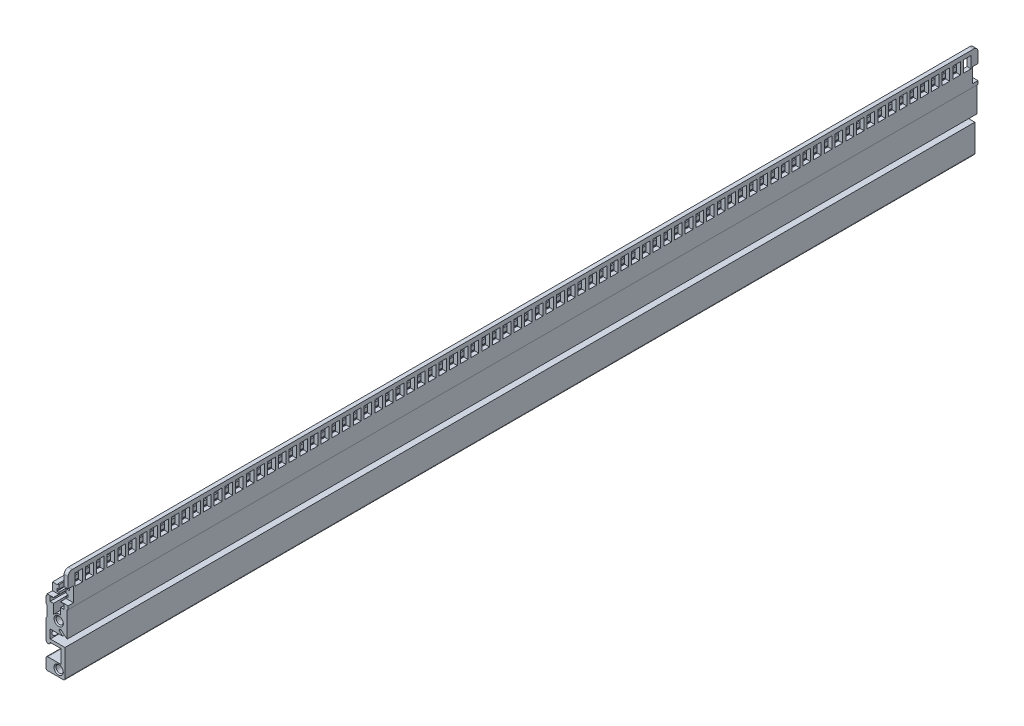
SolidWorks part; units mm, degrees
ref_plane "前视基准面" through (0, 0, 0) normal (0, 0, 1) x (1, 0, 0)
ref_plane "上视基准面" through (0, 0, 0) normal (0, 1, 0) x (1, 0, 0)
ref_plane "右视基准面" through (0, 0, 0) normal (1, 0, 0) x (0, 0, -1)
sketch "草图1" plane through (0, 0, 0) normal (0, 0, 1) x (1, 0, 0)
  line L0 (2.6, 12.5) -> (2.6, 22.5)
  line L1 (0.95, 12.5) -> (2.6, 12.5)
  line L2 (2.6, 22.5) -> (4.5, 22.5)
  line L3 (0.95, 10.55) -> (0.95, 12.5)
  line L4 (4.5, 22.5) -> (4.5, 6.95)
  line L5 (1.85, 10.55) -> (0.95, 10.55)
  line L6 (4, 6.45) -> (4.5, 6.95)
  line L7 (1.85, 9.35) -> (1.85, 10.55)
  line L8 (4, 6.45) -> (4, -5.4458)
  line L9 (0.95, 9.35) -> (1.85, 9.35)
  line L10 (1.2224, -3.1152) -> (4, -5.4458)
  line L11 (0.95, 8.35) -> (0.95, 9.35)
  line L12 (2.55, 8.35) -> (0.95, 8.35)
  line L13 (0.4511, -4.0344) -> (1.8998, -5.25)
  line L14 (2.55, 6.05) -> (2.55, 8.35)
  line L15 (-4, -5.25) -> (1.8998, -5.25)
  line L16 (0.95, 6.05) -> (2.55, 6.05)
  line L17 (-4, -9.35) -> (-4, -5.25)
  line L18 (0.95, 2.9172) -> (0.95, 6.05)
  line L19 (-4, -9.35) -> (3, -9.35)
  line L20 (3, -9.35) -> (3, -22.2)
  line L21 (-2.45, 6.05) -> (-2.45, 1.3077)
  line L22 (-4.05, 6.05) -> (-2.45, 6.05)
  line L23 (2.2, -23) -> (-5.2, -23)
  line L24 (-4.05, 8.35) -> (-4.05, 6.05)
  line L25 (-2.45, 8.35) -> (-4.05, 8.35)
  line L26 (-6, -22.2) -> (-6, -18.05)
  line L27 (-2.45, 9.35) -> (-2.45, 8.35)
  line L28 (-3.35, 9.35) -> (-2.45, 9.35)
  line L29 (-5.2, -17.25) -> (1, -17.25)
  line L30 (-3.35, 10.55) -> (-3.35, 9.35)
  line L31 (1, -10.75) -> (1, -17.25)
  line L32 (-2.45, 10.55) -> (-3.35, 10.55)
  line L33 (-4, -10.75) -> (1, -10.75)
  line L34 (-2.45, 12.5) -> (-2.45, 10.55)
  line L35 (-2.45, 12.5) -> (-3, 12.5)
  line L36 (-6, -10.75) -> (-6, -1.6)
  line L37 (-3, 12.5) -> (-3, 12.1)
  line L38 (-6, -1.6) -> (-5.5501, -1.1002)
  line L39 (-3, 12.1) -> (-5.45, 12.1)
  line L40 (-5.5499, 3.8998) -> (-5.5501, -1.1002)
  line L41 (-5.45, 12.1) -> (-5.45, 7.7)
  line L42 (-5.5499, 3.8998) -> (-6, 4.4)
  line L43 (-5.45, 7.7) -> (-5.7, 7.7)
  line L44 (-6, 4.4) -> (-6, 7.4)
  line L45 (-6, 7.4) -> (-5.7, 7.7)
  circle A0 centre (0, 0) radius 1.7
  circle A1 centre (0, -20) radius 1.7
  arc A2 (1.2224, -3.1152) -> (0.4511, -4.0344) centre (0.8368, -3.5748) ccw
  arc A3 (0.95, 2.9172) -> (-2.45, 1.3077) centre (0.25, 0) ccw
  arc A4 (2.2, -23) -> (3, -22.2) centre (2.2, -22.2) ccw
  arc A5 (-6, -22.2) -> (-5.2, -23) centre (-5.2, -22.2) ccw
  arc A6 (-5.2, -17.25) -> (-6, -18.05) centre (-5.2, -18.05) ccw
  arc A7 (-6, -10.75) -> (-4, -10.75) centre (-5, -10.75) ccw
extrude "凸台-拉伸1" add sketch "草图1" against normal blind 431.8
fillet "圆角1" radius 2 2 edges at (3.55, 22.5, -431.8) (3.55, 22.5, 0)
sketch "草图2" plane through (4.5, 0, 0) normal (1, 0, 0) x (0, 0, -1)
  line L0 (8.36, 20.45) -> (11.96, 20.45)
  line L1 (3.28, 20.45) -> (6.88, 20.45)
  line L2 (3.28, 20.45) -> (3.28, 14.95)
  line L3 (3.28, 14.95) -> (6.88, 14.95)
  line L4 (6.88, 20.45) -> (6.88, 14.95)
  line L5 (5.08, 20.45) -> (5.08, 14.95) construction
  line L6 (3.28, 17.7) -> (6.88, 17.7) construction
  line L7 (429.8, 22.5) -> (2, 22.5) construction
  line L8 (0, 20.5) -> (0, 12.5) construction
  line L9 (8.36, 20.45) -> (8.36, 14.95)
  line L10 (8.36, 14.95) -> (11.96, 14.95)
  line L11 (11.96, 20.45) -> (11.96, 14.95)
  line L12 (10.16, 20.45) -> (10.16, 14.95) construction
  line L13 (8.36, 17.7) -> (11.96, 17.7) construction
  line L14 (13.44, 20.45) -> (17.04, 20.45)
  line L15 (13.44, 20.45) -> (13.44, 14.95)
  line L16 (13.44, 14.95) -> (17.04, 14.95)
  line L17 (17.04, 20.45) -> (17.04, 14.95)
  line L18 (15.24, 20.45) -> (15.24, 14.95) construction
  line L19 (13.44, 17.7) -> (17.04, 17.7) construction
  line L20 (18.52, 20.45) -> (22.12, 20.45)
  line L21 (18.52, 20.45) -> (18.52, 14.95)
  line L22 (18.52, 14.95) -> (22.12, 14.95)
  line L23 (22.12, 20.45) -> (22.12, 14.95)
  line L24 (20.32, 20.45) -> (20.32, 14.95) construction
  line L25 (18.52, 17.7) -> (22.12, 17.7) construction
  line L26 (23.6, 20.45) -> (27.2, 20.45)
  line L27 (23.6, 20.45) -> (23.6, 14.95)
  line L28 (23.6, 14.95) -> (27.2, 14.95)
  line L29 (27.2, 20.45) -> (27.2, 14.95)
  line L30 (25.4, 20.45) -> (25.4, 14.95) construction
  line L31 (23.6, 17.7) -> (27.2, 17.7) construction
  line L32 (28.68, 20.45) -> (32.28, 20.45)
  line L33 (28.68, 20.45) -> (28.68, 14.95)
  line L34 (28.68, 14.95) -> (32.28, 14.95)
  line L35 (32.28, 20.45) -> (32.28, 14.95)
  line L36 (30.48, 20.45) -> (30.48, 14.95) construction
  line L37 (28.68, 17.7) -> (32.28, 17.7) construction
  line L38 (33.76, 20.45) -> (37.36, 20.45)
  line L39 (33.76, 20.45) -> (33.76, 14.95)
  line L40 (33.76, 14.95) -> (37.36, 14.95)
  line L41 (37.36, 20.45) -> (37.36, 14.95)
  line L42 (35.56, 20.45) -> (35.56, 14.95) construction
  line L43 (33.76, 17.7) -> (37.36, 17.7) construction
  line L44 (38.84, 20.45) -> (42.44, 20.45)
  line L45 (38.84, 20.45) -> (38.84, 14.95)
  line L46 (38.84, 14.95) -> (42.44, 14.95)
  line L47 (42.44, 20.45) -> (42.44, 14.95)
  line L48 (40.64, 20.45) -> (40.64, 14.95) construction
  line L49 (38.84, 17.7) -> (42.44, 17.7) construction
  line L50 (43.92, 20.45) -> (47.52, 20.45)
  line L51 (43.92, 20.45) -> (43.92, 14.95)
  line L52 (43.92, 14.95) -> (47.52, 14.95)
  line L53 (47.52, 20.45) -> (47.52, 14.95)
  line L54 (45.72, 20.45) -> (45.72, 14.95) construction
  line L55 (43.92, 17.7) -> (47.52, 17.7) construction
  line L56 (49, 20.45) -> (52.6, 20.45)
  line L57 (49, 20.45) -> (49, 14.95)
  line L58 (49, 14.95) -> (52.6, 14.95)
  line L59 (52.6, 20.45) -> (52.6, 14.95)
  line L60 (50.8, 20.45) -> (50.8, 14.95) construction
  line L61 (49, 17.7) -> (52.6, 17.7) construction
  line L62 (54.08, 20.45) -> (57.68, 20.45)
  line L63 (54.08, 20.45) -> (54.08, 14.95)
  line L64 (54.08, 14.95) -> (57.68, 14.95)
  line L65 (57.68, 20.45) -> (57.68, 14.95)
  line L66 (55.88, 20.45) -> (55.88, 14.95) construction
  line L67 (54.08, 17.7) -> (57.68, 17.7) construction
  line L68 (59.16, 20.45) -> (62.76, 20.45)
  line L69 (59.16, 20.45) -> (59.16, 14.95)
  line L70 (59.16, 14.95) -> (62.76, 14.95)
  line L71 (62.76, 20.45) -> (62.76, 14.95)
  line L72 (60.96, 20.45) -> (60.96, 14.95) construction
  line L73 (59.16, 17.7) -> (62.76, 17.7) construction
  line L74 (64.24, 20.45) -> (67.84, 20.45)
  line L75 (64.24, 20.45) -> (64.24, 14.95)
  line L76 (64.24, 14.95) -> (67.84, 14.95)
  line L77 (67.84, 20.45) -> (67.84, 14.95)
  line L78 (66.04, 20.45) -> (66.04, 14.95) construction
  line L79 (64.24, 17.7) -> (67.84, 17.7) construction
  line L80 (69.32, 20.45) -> (72.92, 20.45)
  line L81 (69.32, 20.45) -> (69.32, 14.95)
  line L82 (69.32, 14.95) -> (72.92, 14.95)
  line L83 (72.92, 20.45) -> (72.92, 14.95)
  line L84 (71.12, 20.45) -> (71.12, 14.95) construction
  line L85 (69.32, 17.7) -> (72.92, 17.7) construction
  line L86 (74.4, 20.45) -> (78, 20.45)
  line L87 (74.4, 20.45) -> (74.4, 14.95)
  line L88 (74.4, 14.95) -> (78, 14.95)
  line L89 (78, 20.45) -> (78, 14.95)
  line L90 (76.2, 20.45) -> (76.2, 14.95) construction
  line L91 (74.4, 17.7) -> (78, 17.7) construction
  line L92 (79.48, 20.45) -> (83.08, 20.45)
  line L93 (79.48, 20.45) -> (79.48, 14.95)
  line L94 (79.48, 14.95) -> (83.08, 14.95)
  line L95 (83.08, 20.45) -> (83.08, 14.95)
  line L96 (81.28, 20.45) -> (81.28, 14.95) construction
  line L97 (79.48, 17.7) -> (83.08, 17.7) construction
  line L98 (84.56, 20.45) -> (88.16, 20.45)
  line L99 (84.56, 20.45) -> (84.56, 14.95)
  line L100 (84.56, 14.95) -> (88.16, 14.95)
  line L101 (88.16, 20.45) -> (88.16, 14.95)
  line L102 (86.36, 20.45) -> (86.36, 14.95) construction
  line L103 (84.56, 17.7) -> (88.16, 17.7) construction
  line L104 (89.64, 20.45) -> (93.24, 20.45)
  line L105 (89.64, 20.45) -> (89.64, 14.95)
  line L106 (89.64, 14.95) -> (93.24, 14.95)
  line L107 (93.24, 20.45) -> (93.24, 14.95)
  line L108 (91.44, 20.45) -> (91.44, 14.95) construction
  line L109 (89.64, 17.7) -> (93.24, 17.7) construction
  line L110 (94.72, 20.45) -> (98.32, 20.45)
  line L111 (94.72, 20.45) -> (94.72, 14.95)
  line L112 (94.72, 14.95) -> (98.32, 14.95)
  line L113 (98.32, 20.45) -> (98.32, 14.95)
  line L114 (96.52, 20.45) -> (96.52, 14.95) construction
  line L115 (94.72, 17.7) -> (98.32, 17.7) construction
  line L116 (99.8, 20.45) -> (103.4, 20.45)
  line L117 (99.8, 20.45) -> (99.8, 14.95)
  line L118 (99.8, 14.95) -> (103.4, 14.95)
  line L119 (103.4, 20.45) -> (103.4, 14.95)
  line L120 (101.6, 20.45) -> (101.6, 14.95) construction
  line L121 (99.8, 17.7) -> (103.4, 17.7) construction
  line L122 (104.88, 20.45) -> (108.48, 20.45)
  line L123 (104.88, 20.45) -> (104.88, 14.95)
  line L124 (104.88, 14.95) -> (108.48, 14.95)
  line L125 (108.48, 20.45) -> (108.48, 14.95)
  line L126 (106.68, 20.45) -> (106.68, 14.95) construction
  line L127 (104.88, 17.7) -> (108.48, 17.7) construction
  line L128 (109.96, 20.45) -> (113.56, 20.45)
  line L129 (109.96, 20.45) -> (109.96, 14.95)
  line L130 (109.96, 14.95) -> (113.56, 14.95)
  line L131 (113.56, 20.45) -> (113.56, 14.95)
  line L132 (111.76, 20.45) -> (111.76, 14.95) construction
  line L133 (109.96, 17.7) -> (113.56, 17.7) construction
  line L134 (115.04, 20.45) -> (118.64, 20.45)
  line L135 (115.04, 20.45) -> (115.04, 14.95)
  line L136 (115.04, 14.95) -> (118.64, 14.95)
  line L137 (118.64, 20.45) -> (118.64, 14.95)
  line L138 (116.84, 20.45) -> (116.84, 14.95) construction
  line L139 (115.04, 17.7) -> (118.64, 17.7) construction
  line L140 (120.12, 20.45) -> (123.72, 20.45)
  line L141 (120.12, 20.45) -> (120.12, 14.95)
  line L142 (120.12, 14.95) -> (123.72, 14.95)
  line L143 (123.72, 20.45) -> (123.72, 14.95)
  line L144 (121.92, 20.45) -> (121.92, 14.95) construction
  line L145 (120.12, 17.7) -> (123.72, 17.7) construction
  line L146 (125.2, 20.45) -> (128.8, 20.45)
  line L147 (125.2, 20.45) -> (125.2, 14.95)
  line L148 (125.2, 14.95) -> (128.8, 14.95)
  line L149 (128.8, 20.45) -> (128.8, 14.95)
  line L150 (127, 20.45) -> (127, 14.95) construction
  line L151 (125.2, 17.7) -> (128.8, 17.7) construction
  line L152 (130.28, 20.45) -> (133.88, 20.45)
  line L153 (130.28, 20.45) -> (130.28, 14.95)
  line L154 (130.28, 14.95) -> (133.88, 14.95)
  line L155 (133.88, 20.45) -> (133.88, 14.95)
  line L156 (132.08, 20.45) -> (132.08, 14.95) construction
  line L157 (130.28, 17.7) -> (133.88, 17.7) construction
  line L158 (135.36, 20.45) -> (138.96, 20.45)
  line L159 (135.36, 20.45) -> (135.36, 14.95)
  line L160 (135.36, 14.95) -> (138.96, 14.95)
  line L161 (138.96, 20.45) -> (138.96, 14.95)
  line L162 (137.16, 20.45) -> (137.16, 14.95) construction
  line L163 (135.36, 17.7) -> (138.96, 17.7) construction
  line L164 (140.44, 20.45) -> (144.04, 20.45)
  line L165 (140.44, 20.45) -> (140.44, 14.95)
  line L166 (140.44, 14.95) -> (144.04, 14.95)
  line L167 (144.04, 20.45) -> (144.04, 14.95)
  line L168 (142.24, 20.45) -> (142.24, 14.95) construction
  line L169 (140.44, 17.7) -> (144.04, 17.7) construction
  line L170 (145.52, 20.45) -> (149.12, 20.45)
  line L171 (145.52, 20.45) -> (145.52, 14.95)
  line L172 (145.52, 14.95) -> (149.12, 14.95)
  line L173 (149.12, 20.45) -> (149.12, 14.95)
  line L174 (147.32, 20.45) -> (147.32, 14.95) construction
  line L175 (145.52, 17.7) -> (149.12, 17.7) construction
  line L176 (150.6, 20.45) -> (154.2, 20.45)
  line L177 (150.6, 20.45) -> (150.6, 14.95)
  line L178 (150.6, 14.95) -> (154.2, 14.95)
  line L179 (154.2, 20.45) -> (154.2, 14.95)
  line L180 (152.4, 20.45) -> (152.4, 14.95) construction
  line L181 (150.6, 17.7) -> (154.2, 17.7) construction
  line L182 (155.68, 20.45) -> (159.28, 20.45)
  line L183 (155.68, 20.45) -> (155.68, 14.95)
  line L184 (155.68, 14.95) -> (159.28, 14.95)
  line L185 (159.28, 20.45) -> (159.28, 14.95)
  line L186 (157.48, 20.45) -> (157.48, 14.95) construction
  line L187 (155.68, 17.7) -> (159.28, 17.7) construction
  line L188 (160.76, 20.45) -> (164.36, 20.45)
  line L189 (160.76, 20.45) -> (160.76, 14.95)
  line L190 (160.76, 14.95) -> (164.36, 14.95)
  line L191 (164.36, 20.45) -> (164.36, 14.95)
  line L192 (162.56, 20.45) -> (162.56, 14.95) construction
  line L193 (160.76, 17.7) -> (164.36, 17.7) construction
  line L194 (165.84, 20.45) -> (169.44, 20.45)
  line L195 (165.84, 20.45) -> (165.84, 14.95)
  line L196 (165.84, 14.95) -> (169.44, 14.95)
  line L197 (169.44, 20.45) -> (169.44, 14.95)
  line L198 (167.64, 20.45) -> (167.64, 14.95) construction
  line L199 (165.84, 17.7) -> (169.44, 17.7) construction
  line L200 (170.92, 20.45) -> (174.52, 20.45)
  line L201 (170.92, 20.45) -> (170.92, 14.95)
  line L202 (170.92, 14.95) -> (174.52, 14.95)
  line L203 (174.52, 20.45) -> (174.52, 14.95)
  line L204 (172.72, 20.45) -> (172.72, 14.95) construction
  line L205 (170.92, 17.7) -> (174.52, 17.7) construction
  line L206 (176, 20.45) -> (179.6, 20.45)
  line L207 (176, 20.45) -> (176, 14.95)
  line L208 (176, 14.95) -> (179.6, 14.95)
  line L209 (179.6, 20.45) -> (179.6, 14.95)
  line L210 (177.8, 20.45) -> (177.8, 14.95) construction
  line L211 (176, 17.7) -> (179.6, 17.7) construction
  line L212 (181.08, 20.45) -> (184.68, 20.45)
  line L213 (181.08, 20.45) -> (181.08, 14.95)
  line L214 (181.08, 14.95) -> (184.68, 14.95)
  line L215 (184.68, 20.45) -> (184.68, 14.95)
  line L216 (182.88, 20.45) -> (182.88, 14.95) construction
  line L217 (181.08, 17.7) -> (184.68, 17.7) construction
  line L218 (186.16, 20.45) -> (189.76, 20.45)
  line L219 (186.16, 20.45) -> (186.16, 14.95)
  line L220 (186.16, 14.95) -> (189.76, 14.95)
  line L221 (189.76, 20.45) -> (189.76, 14.95)
  line L222 (187.96, 20.45) -> (187.96, 14.95) construction
  line L223 (186.16, 17.7) -> (189.76, 17.7) construction
  line L224 (191.24, 20.45) -> (194.84, 20.45)
  line L225 (191.24, 20.45) -> (191.24, 14.95)
  line L226 (191.24, 14.95) -> (194.84, 14.95)
  line L227 (194.84, 20.45) -> (194.84, 14.95)
  line L228 (193.04, 20.45) -> (193.04, 14.95) construction
  line L229 (191.24, 17.7) -> (194.84, 17.7) construction
  line L230 (196.32, 20.45) -> (199.92, 20.45)
  line L231 (196.32, 20.45) -> (196.32, 14.95)
  line L232 (196.32, 14.95) -> (199.92, 14.95)
  line L233 (199.92, 20.45) -> (199.92, 14.95)
  line L234 (198.12, 20.45) -> (198.12, 14.95) construction
  line L235 (196.32, 17.7) -> (199.92, 17.7) construction
  line L236 (201.4, 20.45) -> (205, 20.45)
  line L237 (201.4, 20.45) -> (201.4, 14.95)
  line L238 (201.4, 14.95) -> (205, 14.95)
  line L239 (205, 20.45) -> (205, 14.95)
  line L240 (203.2, 20.45) -> (203.2, 14.95) construction
  line L241 (201.4, 17.7) -> (205, 17.7) construction
  line L242 (206.48, 20.45) -> (210.08, 20.45)
  line L243 (206.48, 20.45) -> (206.48, 14.95)
  line L244 (206.48, 14.95) -> (210.08, 14.95)
  line L245 (210.08, 20.45) -> (210.08, 14.95)
  line L246 (208.28, 20.45) -> (208.28, 14.95) construction
  line L247 (206.48, 17.7) -> (210.08, 17.7) construction
  line L248 (211.56, 20.45) -> (215.16, 20.45)
  line L249 (211.56, 20.45) -> (211.56, 14.95)
  line L250 (211.56, 14.95) -> (215.16, 14.95)
  line L251 (215.16, 20.45) -> (215.16, 14.95)
  line L252 (213.36, 20.45) -> (213.36, 14.95) construction
  line L253 (211.56, 17.7) -> (215.16, 17.7) construction
  line L254 (216.64, 20.45) -> (220.24, 20.45)
  line L255 (216.64, 20.45) -> (216.64, 14.95)
  line L256 (216.64, 14.95) -> (220.24, 14.95)
  line L257 (220.24, 20.45) -> (220.24, 14.95)
  line L258 (218.44, 20.45) -> (218.44, 14.95) construction
  line L259 (216.64, 17.7) -> (220.24, 17.7) construction
  line L260 (221.72, 20.45) -> (225.32, 20.45)
  line L261 (221.72, 20.45) -> (221.72, 14.95)
  line L262 (221.72, 14.95) -> (225.32, 14.95)
  line L263 (225.32, 20.45) -> (225.32, 14.95)
  line L264 (223.52, 20.45) -> (223.52, 14.95) construction
  line L265 (221.72, 17.7) -> (225.32, 17.7) construction
  line L266 (226.8, 20.45) -> (230.4, 20.45)
  line L267 (226.8, 20.45) -> (226.8, 14.95)
  line L268 (226.8, 14.95) -> (230.4, 14.95)
  line L269 (230.4, 20.45) -> (230.4, 14.95)
  line L270 (228.6, 20.45) -> (228.6, 14.95) construction
  line L271 (226.8, 17.7) -> (230.4, 17.7) construction
  line L272 (231.88, 20.45) -> (235.48, 20.45)
  line L273 (231.88, 20.45) -> (231.88, 14.95)
  line L274 (231.88, 14.95) -> (235.48, 14.95)
  line L275 (235.48, 20.45) -> (235.48, 14.95)
  line L276 (233.68, 20.45) -> (233.68, 14.95) construction
  line L277 (231.88, 17.7) -> (235.48, 17.7) construction
  line L278 (236.96, 20.45) -> (240.56, 20.45)
  line L279 (236.96, 20.45) -> (236.96, 14.95)
  line L280 (236.96, 14.95) -> (240.56, 14.95)
  line L281 (240.56, 20.45) -> (240.56, 14.95)
  line L282 (238.76, 20.45) -> (238.76, 14.95) construction
  line L283 (236.96, 17.7) -> (240.56, 17.7) construction
  line L284 (242.04, 20.45) -> (245.64, 20.45)
  line L285 (242.04, 20.45) -> (242.04, 14.95)
  line L286 (242.04, 14.95) -> (245.64, 14.95)
  line L287 (245.64, 20.45) -> (245.64, 14.95)
  line L288 (243.84, 20.45) -> (243.84, 14.95) construction
  line L289 (242.04, 17.7) -> (245.64, 17.7) construction
  line L290 (247.12, 20.45) -> (250.72, 20.45)
  line L291 (247.12, 20.45) -> (247.12, 14.95)
  line L292 (247.12, 14.95) -> (250.72, 14.95)
  line L293 (250.72, 20.45) -> (250.72, 14.95)
  line L294 (248.92, 20.45) -> (248.92, 14.95) construction
  line L295 (247.12, 17.7) -> (250.72, 17.7) construction
  line L296 (252.2, 20.45) -> (255.8, 20.45)
  line L297 (252.2, 20.45) -> (252.2, 14.95)
  line L298 (252.2, 14.95) -> (255.8, 14.95)
  line L299 (255.8, 20.45) -> (255.8, 14.95)
  line L300 (254, 20.45) -> (254, 14.95) construction
  line L301 (252.2, 17.7) -> (255.8, 17.7) construction
  line L302 (257.28, 20.45) -> (260.88, 20.45)
  line L303 (257.28, 20.45) -> (257.28, 14.95)
  line L304 (257.28, 14.95) -> (260.88, 14.95)
  line L305 (260.88, 20.45) -> (260.88, 14.95)
  line L306 (259.08, 20.45) -> (259.08, 14.95) construction
  line L307 (257.28, 17.7) -> (260.88, 17.7) construction
  line L308 (262.36, 20.45) -> (265.96, 20.45)
  line L309 (262.36, 20.45) -> (262.36, 14.95)
  line L310 (262.36, 14.95) -> (265.96, 14.95)
  line L311 (265.96, 20.45) -> (265.96, 14.95)
  line L312 (264.16, 20.45) -> (264.16, 14.95) construction
  line L313 (262.36, 17.7) -> (265.96, 17.7) construction
  line L314 (267.44, 20.45) -> (271.04, 20.45)
  line L315 (267.44, 20.45) -> (267.44, 14.95)
  line L316 (267.44, 14.95) -> (271.04, 14.95)
  line L317 (271.04, 20.45) -> (271.04, 14.95)
  line L318 (269.24, 20.45) -> (269.24, 14.95) construction
  line L319 (267.44, 17.7) -> (271.04, 17.7) construction
  line L320 (272.52, 20.45) -> (276.12, 20.45)
  line L321 (272.52, 20.45) -> (272.52, 14.95)
  line L322 (272.52, 14.95) -> (276.12, 14.95)
  line L323 (276.12, 20.45) -> (276.12, 14.95)
  line L324 (274.32, 20.45) -> (274.32, 14.95) construction
  line L325 (272.52, 17.7) -> (276.12, 17.7) construction
  line L326 (277.6, 20.45) -> (281.2, 20.45)
  line L327 (277.6, 20.45) -> (277.6, 14.95)
  line L328 (277.6, 14.95) -> (281.2, 14.95)
  line L329 (281.2, 20.45) -> (281.2, 14.95)
  line L330 (279.4, 20.45) -> (279.4, 14.95) construction
  line L331 (277.6, 17.7) -> (281.2, 17.7) construction
  line L332 (282.68, 20.45) -> (286.28, 20.45)
  line L333 (282.68, 20.45) -> (282.68, 14.95)
  line L334 (282.68, 14.95) -> (286.28, 14.95)
  line L335 (286.28, 20.45) -> (286.28, 14.95)
  line L336 (284.48, 20.45) -> (284.48, 14.95) construction
  line L337 (282.68, 17.7) -> (286.28, 17.7) construction
  line L338 (287.76, 20.45) -> (291.36, 20.45)
  line L339 (287.76, 20.45) -> (287.76, 14.95)
  line L340 (287.76, 14.95) -> (291.36, 14.95)
  line L341 (291.36, 20.45) -> (291.36, 14.95)
  line L342 (289.56, 20.45) -> (289.56, 14.95) construction
  line L343 (287.76, 17.7) -> (291.36, 17.7) construction
  line L344 (292.84, 20.45) -> (296.44, 20.45)
  line L345 (292.84, 20.45) -> (292.84, 14.95)
  line L346 (292.84, 14.95) -> (296.44, 14.95)
  line L347 (296.44, 20.45) -> (296.44, 14.95)
  line L348 (294.64, 20.45) -> (294.64, 14.95) construction
  line L349 (292.84, 17.7) -> (296.44, 17.7) construction
  line L350 (297.92, 20.45) -> (301.52, 20.45)
  line L351 (297.92, 20.45) -> (297.92, 14.95)
  line L352 (297.92, 14.95) -> (301.52, 14.95)
  line L353 (301.52, 20.45) -> (301.52, 14.95)
  line L354 (299.72, 20.45) -> (299.72, 14.95) construction
  line L355 (297.92, 17.7) -> (301.52, 17.7) construction
  line L356 (303, 20.45) -> (306.6, 20.45)
  line L357 (303, 20.45) -> (303, 14.95)
  line L358 (303, 14.95) -> (306.6, 14.95)
  line L359 (306.6, 20.45) -> (306.6, 14.95)
  line L360 (304.8, 20.45) -> (304.8, 14.95) construction
  line L361 (303, 17.7) -> (306.6, 17.7) construction
  line L362 (308.08, 20.45) -> (311.68, 20.45)
  line L363 (308.08, 20.45) -> (308.08, 14.95)
  line L364 (308.08, 14.95) -> (311.68, 14.95)
  line L365 (311.68, 20.45) -> (311.68, 14.95)
  line L366 (309.88, 20.45) -> (309.88, 14.95) construction
  line L367 (308.08, 17.7) -> (311.68, 17.7) construction
  line L368 (313.16, 20.45) -> (316.76, 20.45)
  line L369 (313.16, 20.45) -> (313.16, 14.95)
  line L370 (313.16, 14.95) -> (316.76, 14.95)
  line L371 (316.76, 20.45) -> (316.76, 14.95)
  line L372 (314.96, 20.45) -> (314.96, 14.95) construction
  line L373 (313.16, 17.7) -> (316.76, 17.7) construction
  line L374 (318.24, 20.45) -> (321.84, 20.45)
  line L375 (318.24, 20.45) -> (318.24, 14.95)
  line L376 (318.24, 14.95) -> (321.84, 14.95)
  line L377 (321.84, 20.45) -> (321.84, 14.95)
  line L378 (320.04, 20.45) -> (320.04, 14.95) construction
  line L379 (318.24, 17.7) -> (321.84, 17.7) construction
  line L380 (323.32, 20.45) -> (326.92, 20.45)
  line L381 (323.32, 20.45) -> (323.32, 14.95)
  line L382 (323.32, 14.95) -> (326.92, 14.95)
  line L383 (326.92, 20.45) -> (326.92, 14.95)
  line L384 (325.12, 20.45) -> (325.12, 14.95) construction
  line L385 (323.32, 17.7) -> (326.92, 17.7) construction
  line L386 (328.4, 20.45) -> (332, 20.45)
  line L387 (328.4, 20.45) -> (328.4, 14.95)
  line L388 (328.4, 14.95) -> (332, 14.95)
  line L389 (332, 20.45) -> (332, 14.95)
  line L390 (330.2, 20.45) -> (330.2, 14.95) construction
  line L391 (328.4, 17.7) -> (332, 17.7) construction
  line L392 (333.48, 20.45) -> (337.08, 20.45)
  line L393 (333.48, 20.45) -> (333.48, 14.95)
  line L394 (333.48, 14.95) -> (337.08, 14.95)
  line L395 (337.08, 20.45) -> (337.08, 14.95)
  line L396 (335.28, 20.45) -> (335.28, 14.95) construction
  line L397 (333.48, 17.7) -> (337.08, 17.7) construction
  line L398 (338.56, 20.45) -> (342.16, 20.45)
  line L399 (338.56, 20.45) -> (338.56, 14.95)
  line L400 (338.56, 14.95) -> (342.16, 14.95)
  line L401 (342.16, 20.45) -> (342.16, 14.95)
  line L402 (340.36, 20.45) -> (340.36, 14.95) construction
  line L403 (338.56, 17.7) -> (342.16, 17.7) construction
  line L404 (343.64, 20.45) -> (347.24, 20.45)
  line L405 (343.64, 20.45) -> (343.64, 14.95)
  line L406 (343.64, 14.95) -> (347.24, 14.95)
  line L407 (347.24, 20.45) -> (347.24, 14.95)
  line L408 (345.44, 20.45) -> (345.44, 14.95) construction
  line L409 (343.64, 17.7) -> (347.24, 17.7) construction
  line L410 (348.72, 20.45) -> (352.32, 20.45)
  line L411 (348.72, 20.45) -> (348.72, 14.95)
  line L412 (348.72, 14.95) -> (352.32, 14.95)
  line L413 (352.32, 20.45) -> (352.32, 14.95)
  line L414 (350.52, 20.45) -> (350.52, 14.95) construction
  line L415 (348.72, 17.7) -> (352.32, 17.7) construction
  line L416 (353.8, 20.45) -> (357.4, 20.45)
  line L417 (353.8, 20.45) -> (353.8, 14.95)
  line L418 (353.8, 14.95) -> (357.4, 14.95)
  line L419 (357.4, 20.45) -> (357.4, 14.95)
  line L420 (355.6, 20.45) -> (355.6, 14.95) construction
  line L421 (353.8, 17.7) -> (357.4, 17.7) construction
  line L422 (358.88, 20.45) -> (362.48, 20.45)
  line L423 (358.88, 20.45) -> (358.88, 14.95)
  line L424 (358.88, 14.95) -> (362.48, 14.95)
  line L425 (362.48, 20.45) -> (362.48, 14.95)
  line L426 (360.68, 20.45) -> (360.68, 14.95) construction
  line L427 (358.88, 17.7) -> (362.48, 17.7) construction
  line L428 (363.96, 20.45) -> (367.56, 20.45)
  line L429 (363.96, 20.45) -> (363.96, 14.95)
  line L430 (363.96, 14.95) -> (367.56, 14.95)
  line L431 (367.56, 20.45) -> (367.56, 14.95)
  line L432 (365.76, 20.45) -> (365.76, 14.95) construction
  line L433 (363.96, 17.7) -> (367.56, 17.7) construction
  line L434 (369.04, 20.45) -> (372.64, 20.45)
  line L435 (369.04, 20.45) -> (369.04, 14.95)
  line L436 (369.04, 14.95) -> (372.64, 14.95)
  line L437 (372.64, 20.45) -> (372.64, 14.95)
  line L438 (370.84, 20.45) -> (370.84, 14.95) construction
  line L439 (369.04, 17.7) -> (372.64, 17.7) construction
  line L440 (374.12, 20.45) -> (377.72, 20.45)
  line L441 (374.12, 20.45) -> (374.12, 14.95)
  line L442 (374.12, 14.95) -> (377.72, 14.95)
  line L443 (377.72, 20.45) -> (377.72, 14.95)
  line L444 (375.92, 20.45) -> (375.92, 14.95) construction
  line L445 (374.12, 17.7) -> (377.72, 17.7) construction
  line L446 (379.2, 20.45) -> (382.8, 20.45)
  line L447 (379.2, 20.45) -> (379.2, 14.95)
  line L448 (379.2, 14.95) -> (382.8, 14.95)
  line L449 (382.8, 20.45) -> (382.8, 14.95)
  line L450 (381, 20.45) -> (381, 14.95) construction
  line L451 (379.2, 17.7) -> (382.8, 17.7) construction
  line L452 (384.28, 20.45) -> (387.88, 20.45)
  line L453 (384.28, 20.45) -> (384.28, 14.95)
  line L454 (384.28, 14.95) -> (387.88, 14.95)
  line L455 (387.88, 20.45) -> (387.88, 14.95)
  line L456 (386.08, 20.45) -> (386.08, 14.95) construction
  line L457 (384.28, 17.7) -> (387.88, 17.7) construction
  line L458 (389.36, 20.45) -> (392.96, 20.45)
  line L459 (389.36, 20.45) -> (389.36, 14.95)
  line L460 (389.36, 14.95) -> (392.96, 14.95)
  line L461 (392.96, 20.45) -> (392.96, 14.95)
  line L462 (391.16, 20.45) -> (391.16, 14.95) construction
  line L463 (389.36, 17.7) -> (392.96, 17.7) construction
  line L464 (394.44, 20.45) -> (398.04, 20.45)
  line L465 (394.44, 20.45) -> (394.44, 14.95)
  line L466 (394.44, 14.95) -> (398.04, 14.95)
  line L467 (398.04, 20.45) -> (398.04, 14.95)
  line L468 (396.24, 20.45) -> (396.24, 14.95) construction
  line L469 (394.44, 17.7) -> (398.04, 17.7) construction
  line L470 (399.52, 20.45) -> (403.12, 20.45)
  line L471 (399.52, 20.45) -> (399.52, 14.95)
  line L472 (399.52, 14.95) -> (403.12, 14.95)
  line L473 (403.12, 20.45) -> (403.12, 14.95)
  line L474 (401.32, 20.45) -> (401.32, 14.95) construction
  line L475 (399.52, 17.7) -> (403.12, 17.7) construction
  line L476 (404.6, 20.45) -> (408.2, 20.45)
  line L477 (404.6, 20.45) -> (404.6, 14.95)
  line L478 (404.6, 14.95) -> (408.2, 14.95)
  line L479 (408.2, 20.45) -> (408.2, 14.95)
  line L480 (406.4, 20.45) -> (406.4, 14.95) construction
  line L481 (404.6, 17.7) -> (408.2, 17.7) construction
  line L482 (409.68, 20.45) -> (413.28, 20.45)
  line L483 (409.68, 20.45) -> (409.68, 14.95)
  line L484 (409.68, 14.95) -> (413.28, 14.95)
  line L485 (413.28, 20.45) -> (413.28, 14.95)
  line L486 (411.48, 20.45) -> (411.48, 14.95) construction
  line L487 (409.68, 17.7) -> (413.28, 17.7) construction
  line L488 (414.76, 20.45) -> (418.36, 20.45)
  line L489 (414.76, 20.45) -> (414.76, 14.95)
  line L490 (414.76, 14.95) -> (418.36, 14.95)
  line L491 (418.36, 20.45) -> (418.36, 14.95)
  line L492 (416.56, 20.45) -> (416.56, 14.95) construction
  line L493 (414.76, 17.7) -> (418.36, 17.7) construction
  line L494 (419.84, 20.45) -> (423.44, 20.45)
  line L495 (419.84, 20.45) -> (419.84, 14.95)
  line L496 (419.84, 14.95) -> (423.44, 14.95)
  line L497 (423.44, 20.45) -> (423.44, 14.95)
  line L498 (421.64, 20.45) -> (421.64, 14.95) construction
  line L499 (419.84, 17.7) -> (423.44, 17.7) construction
  line L500 (424.92, 20.45) -> (428.52, 20.45)
  line L501 (424.92, 20.45) -> (424.92, 14.95)
  line L502 (424.92, 14.95) -> (428.52, 14.95)
  line L503 (428.52, 20.45) -> (428.52, 14.95)
  line L504 (426.72, 20.45) -> (426.72, 14.95) construction
  line L505 (424.92, 17.7) -> (428.52, 17.7) construction
extrude "切除-拉伸1" cut sketch "草图2" against normal up to next (1.9 mm away)
sketch "草图3" plane through (4.5, 0, 0) normal (1, 0, 0) x (0, 0, -1)
  line L0 (429.8, 22.5) -> (2, 22.5) construction
  line L1 (0, 15.5) -> (2.54, 15.5)
  line L2 (0, 15.5) -> (0, 8.5)
  line L3 (0, 8.5) -> (2.54, 8.5)
  line L4 (2.54, 15.5) -> (2.54, 8.5)
  line L6 (0, 6.95) -> (0, 20.5) construction
  dimension "D1" = 7
  dimension "D2" = 2.54
  dimension "D3" = 7
  dimension "D4" = 0
extrude "切除-拉伸2" cut sketch "草图3" against normal through all
ref_plane "基准面2" through (0, 0, -215.9) normal (0, 0, 1) x (1, 0, 0)
mirror "镜向1" about plane through (0, 0, -215.9) normal (0, 0, 1) of "切除-拉伸2"
sketch "草图4" plane through (-6, 0, 0) normal (-1, 0, 0) x (0, 0, 1)
  line L0 (-431.8, -1.6) -> (-431.8, -10.75) construction
  line L1 (-431.8, -9.35) -> (0, -9.35) construction
  circle A0 centre (-429.26, -7.45) radius 1.65
  circle A1 centre (-424.18, -7.45) radius 1.65
  circle A2 centre (-419.1, -7.45) radius 1.65
  circle A3 centre (-414.02, -7.45) radius 1.65
  circle A4 centre (-408.94, -7.45) radius 1.65
  circle A5 centre (-403.86, -7.45) radius 1.65
  circle A6 centre (-398.78, -7.45) radius 1.65
  circle A7 centre (-393.7, -7.45) radius 1.65
  circle A8 centre (-388.62, -7.45) radius 1.65
  circle A9 centre (-383.54, -7.45) radius 1.65
  circle A10 centre (-378.46, -7.45) radius 1.65
  circle A11 centre (-373.38, -7.45) radius 1.65
  circle A12 centre (-368.3, -7.45) radius 1.65
  circle A13 centre (-363.22, -7.45) radius 1.65
  circle A14 centre (-358.14, -7.45) radius 1.65
  circle A15 centre (-353.06, -7.45) radius 1.65
  circle A16 centre (-347.98, -7.45) radius 1.65
  circle A17 centre (-342.9, -7.45) radius 1.65
  circle A18 centre (-337.82, -7.45) radius 1.65
  circle A19 centre (-332.74, -7.45) radius 1.65
  circle A20 centre (-327.66, -7.45) radius 1.65
  circle A21 centre (-322.58, -7.45) radius 1.65
  circle A22 centre (-317.5, -7.45) radius 1.65
  circle A23 centre (-312.42, -7.45) radius 1.65
  circle A24 centre (-307.34, -7.45) radius 1.65
  circle A25 centre (-302.26, -7.45) radius 1.65
  circle A26 centre (-297.18, -7.45) radius 1.65
  circle A27 centre (-292.1, -7.45) radius 1.65
  circle A28 centre (-287.02, -7.45) radius 1.65
  circle A29 centre (-281.94, -7.45) radius 1.65
  circle A30 centre (-276.86, -7.45) radius 1.65
  circle A31 centre (-271.78, -7.45) radius 1.65
  circle A32 centre (-266.7, -7.45) radius 1.65
  circle A33 centre (-261.62, -7.45) radius 1.65
  circle A34 centre (-256.54, -7.45) radius 1.65
  circle A35 centre (-251.46, -7.45) radius 1.65
  circle A36 centre (-246.38, -7.45) radius 1.65
  circle A37 centre (-241.3, -7.45) radius 1.65
  circle A38 centre (-236.22, -7.45) radius 1.65
  circle A39 centre (-231.14, -7.45) radius 1.65
  circle A40 centre (-226.06, -7.45) radius 1.65
  circle A41 centre (-220.98, -7.45) radius 1.65
  circle A42 centre (-215.9, -7.45) radius 1.65
  circle A43 centre (-210.82, -7.45) radius 1.65
  circle A44 centre (-205.74, -7.45) radius 1.65
  circle A45 centre (-200.66, -7.45) radius 1.65
  circle A46 centre (-195.58, -7.45) radius 1.65
  circle A47 centre (-190.5, -7.45) radius 1.65
  circle A48 centre (-185.42, -7.45) radius 1.65
  circle A49 centre (-180.34, -7.45) radius 1.65
  circle A50 centre (-175.26, -7.45) radius 1.65
  circle A51 centre (-170.18, -7.45) radius 1.65
  circle A52 centre (-165.1, -7.45) radius 1.65
  circle A53 centre (-160.02, -7.45) radius 1.65
  circle A54 centre (-154.94, -7.45) radius 1.65
  circle A55 centre (-149.86, -7.45) radius 1.65
  circle A56 centre (-144.78, -7.45) radius 1.65
  circle A57 centre (-139.7, -7.45) radius 1.65
  circle A58 centre (-134.62, -7.45) radius 1.65
  circle A59 centre (-129.54, -7.45) radius 1.65
  circle A60 centre (-124.46, -7.45) radius 1.65
  circle A61 centre (-119.38, -7.45) radius 1.65
  circle A62 centre (-114.3, -7.45) radius 1.65
  circle A63 centre (-109.22, -7.45) radius 1.65
  circle A64 centre (-104.14, -7.45) radius 1.65
  circle A65 centre (-99.06, -7.45) radius 1.65
  circle A66 centre (-93.98, -7.45) radius 1.65
  circle A67 centre (-88.9, -7.45) radius 1.65
  circle A68 centre (-83.82, -7.45) radius 1.65
  circle A69 centre (-78.74, -7.45) radius 1.65
  circle A70 centre (-73.66, -7.45) radius 1.65
  circle A71 centre (-68.58, -7.45) radius 1.65
  circle A72 centre (-63.5, -7.45) radius 1.65
  circle A73 centre (-58.42, -7.45) radius 1.65
  circle A74 centre (-53.34, -7.45) radius 1.65
  circle A75 centre (-48.26, -7.45) radius 1.65
  circle A76 centre (-43.18, -7.45) radius 1.65
  circle A77 centre (-38.1, -7.45) radius 1.65
  circle A78 centre (-33.02, -7.45) radius 1.65
  circle A79 centre (-27.94, -7.45) radius 1.65
  circle A80 centre (-22.86, -7.45) radius 1.65
  circle A81 centre (-17.78, -7.45) radius 1.65
  circle A82 centre (-12.7, -7.45) radius 1.65
  circle A83 centre (-7.62, -7.45) radius 1.65
  circle A84 centre (-2.54, -7.45) radius 1.65
extrude "切除-拉伸3" cut sketch "草图4" against normal up to next (2 mm away)
chamfer "倒角1" distance 0.5 angle 45 3 edges at (1.7, -20, 0) (1.7, 0, 0) (1.7, 0, -431.8)
chamfer "倒角2" distance 0.5 angle 45 1 edges at (1.7, -20, -431.8)
equation "\"D4@草图4\"=\"D1@凸台-拉伸1\"/5.08"
equation "\"D5@草图2\"=\"D1@凸台-拉伸1\"/5.08-1"
